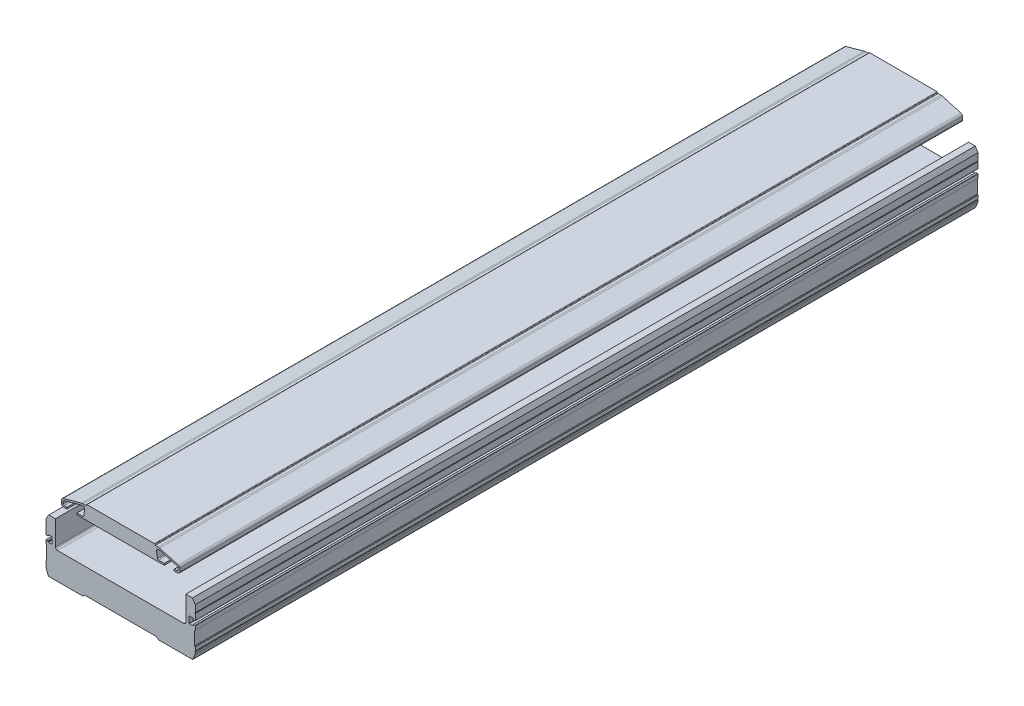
SolidWorks part; units mm, degrees
ref_plane "前视基准面" through (0, 0, 0) normal (0, 0, 1) x (1, 0, 0)
ref_plane "上视基准面" through (0, 0, 0) normal (0, 1, 0) x (1, 0, 0)
ref_plane "右视基准面" through (0, 0, 0) normal (1, 0, 0) x (0, 0, -1)
sketch "草图1" plane through (0, 0, 0) normal (0, 0, 1) x (1, 0, 0)
  line B0 (-51.5, 59.4) -> (-48.5, 59.4)
  line B1 (-48.5, 59.4) -> (-48.5, 60.9)
  line B2 (-48.5, 60.9) -> (-51, 60.9)
  line B3 (-52, 61.9) -> (-52, 63.7046)
  line B4 (-51.27, 64.6675) -> (-35.0485, 69.2164)
  line B5 (-32.5361, 66.9593) -> (-33.4138, 61.7343)
  line B6 (-34.4, 60.9) -> (-39.5, 60.9)
  line B7 (-39.5, 60.9) -> (-39.5, 59.4)
  line B8 (-39.5, 59.4) -> (39.5, 59.4)
  line B9 (39.5, 59.4) -> (39.5, 60.9)
  line B10 (39.5, 60.9) -> (34.4, 60.9)
  line B11 (33.4138, 61.7343) -> (32.5361, 66.9593)
  line B12 (35.0485, 69.2164) -> (51.27, 64.6675)
  line B13 (52, 63.7046) -> (52, 61.9)
  line B14 (51, 60.9) -> (48.5, 60.9)
  line B15 (48.5, 60.9) -> (48.5, 59.4)
  line B16 (48.5, 59.4) -> (51.5, 59.4)
  line B17 (53.5, 61.4) -> (53.5, 64.0837)
  line B18 (52.04, 66.0094) -> (35.2622, 70.7143)
  line B19 (33.9122, 70.9) -> (31.5, 70.9)
  line B20 (30.5, 71.9) -> (-30.5, 71.9)
  line B21 (-31.5, 70.9) -> (-33.9122, 70.9)
  line B22 (-35.2622, 70.7143) -> (-52.04, 66.0094)
  line B23 (-53.5, 64.0837) -> (-53.5, 61.4)
  line B24 (-65.16, -1.6) -> (-34.1, -1.6)
  line B25 (-34.1, -1.6) -> (-32.5, 0)
  line B26 (-32.5, 0) -> (32.5, 0)
  line B27 (32.5, 0) -> (34.1, -1.6)
  line B28 (34.1, -1.6) -> (65.16, -1.6)
  line B29 (65.5064, -1.0289) -> (67.36, 3.6468)
  line B30 (67.5, 4.3812) -> (67.5, 5.625)
  line B31 (67.5, 6.375) -> (67.5, 9.5)
  line B32 (67.5, 9.5) -> (67, 10)
  line B33 (67, 10) -> (67, 22)
  line B34 (67, 22) -> (67.5, 22.5)
  line B35 (67.5, 22.5) -> (67.5, 25.9)
  line B36 (67.2, 26.2) -> (65.8, 26.2)
  line B37 (65.5, 25.9) -> (65.5, 25.3)
  line B38 (65.2, 25) -> (62.3, 25)
  line B39 (62, 25.3) -> (62, 30.7)
  line B40 (62.3, 31) -> (65.2, 31)
  line B41 (65.5, 30.7) -> (65.5, 30.1)
  line B42 (65.8, 29.8) -> (67.2, 29.8)
  line B43 (67.5, 30.1) -> (67.5, 35.625)
  line B44 (67.5, 36.375) -> (67.5, 42.6)
  line B45 (67.5, 42.6) -> (65, 46.6)
  line B46 (65, 46.6) -> (59, 46.6)
  line B47 (59, 46.6) -> (59, 24.7)
  line B48 (57, 22.7) -> (-57, 22.7)
  line B49 (-59, 24.7) -> (-59, 46.6)
  line B50 (-59, 46.6) -> (-65, 46.6)
  line B51 (-65, 46.6) -> (-67.5, 42.6)
  line B52 (-67.5, 42.6) -> (-67.5, 36.375)
  line B53 (-67.5, 35.625) -> (-67.5, 30.1)
  line B54 (-67.2, 29.8) -> (-65.8, 29.8)
  line B55 (-65.5, 30.1) -> (-65.5, 30.7)
  line B56 (-65.2, 31) -> (-62.3, 31)
  line B57 (-62, 30.7) -> (-62, 25.3)
  line B58 (-62.3, 25) -> (-65.2, 25)
  line B59 (-65.5, 25.3) -> (-65.5, 25.9)
  line B60 (-65.8, 26.2) -> (-67.2, 26.2)
  line B61 (-67.5, 25.9) -> (-67.5, 22.5)
  line B62 (-67.5, 22.5) -> (-67, 22)
  line B63 (-67, 22) -> (-67, 10)
  line B64 (-67, 10) -> (-67.5, 9.5)
  line B65 (-67.5, 9.5) -> (-67.5, 6.375)
  line B66 (-67.5, 5.625) -> (-67.5, 4.3812)
  line B67 (-67.36, 3.6468) -> (-65.5064, -1.0289)
  arc B68 (-53.5, 61.4) -> (-51.5, 59.4) centre (-51.5, 61.4) ccw
  arc B69 (-52, 61.9) -> (-51, 60.9) centre (-51, 61.9) ccw
  arc B70 (-51.27, 64.6675) -> (-52, 63.7046) centre (-51, 63.7046) ccw
  arc B71 (-32.5361, 66.9593) -> (-35.0485, 69.2164) centre (-34.5085, 67.2906) ccw
  arc B72 (-34.4, 60.9) -> (-33.4138, 61.7343) centre (-34.4, 61.9) ccw
  arc B73 (33.4138, 61.7343) -> (34.4, 60.9) centre (34.4, 61.9) ccw
  arc B74 (35.0485, 69.2164) -> (32.5361, 66.9593) centre (34.5085, 67.2906) ccw
  arc B75 (52, 63.7046) -> (51.27, 64.6675) centre (51, 63.7046) ccw
  arc B76 (51, 60.9) -> (52, 61.9) centre (51, 61.9) ccw
  arc B77 (51.5, 59.4) -> (53.5, 61.4) centre (51.5, 61.4) ccw
  arc B78 (53.5, 64.0837) -> (52.04, 66.0094) centre (51.5, 64.0837) ccw
  arc B79 (35.2622, 70.7143) -> (33.9122, 70.9) centre (33.9122, 65.9) ccw
  arc B80 (31, 71.4) -> (31.5, 70.9) centre (31.5, 71.4) ccw
  arc B81 (31, 71.4) -> (30.5, 71.9) centre (30.5, 71.4) ccw
  arc B82 (-30.5, 71.9) -> (-31, 71.4) centre (-30.5, 71.4) ccw
  arc B83 (-31.5, 70.9) -> (-31, 71.4) centre (-31.5, 71.4) ccw
  arc B84 (-33.9122, 70.9) -> (-35.2622, 70.7143) centre (-33.9122, 65.9) ccw
  arc B85 (-52.04, 66.0094) -> (-53.5, 64.0837) centre (-51.5, 64.0837) ccw
  arc B86 (-65.5064, -1.0289) -> (-65.16, -1.6) centre (-63.6472, -0.2918) ccw
  arc B87 (65.16, -1.6) -> (65.5064, -1.0289) centre (63.6472, -0.2918) ccw
  arc B88 (67.36, 3.6468) -> (67.5, 4.3812) centre (65.5, 4.382) ccw
  arc B89 (67.5, 6.375) -> (67.5, 5.625) centre (67.5, 6) ccw
  arc B90 (67.5, 25.9) -> (67.2, 26.2) centre (67.2, 25.9) ccw
  arc B91 (65.8, 26.2) -> (65.5, 25.9) centre (65.8, 25.9) ccw
  arc B92 (65.2, 25) -> (65.5, 25.3) centre (65.2, 25.3) ccw
  arc B93 (62, 25.3) -> (62.3, 25) centre (62.3, 25.3) ccw
  arc B94 (62.3, 31) -> (62, 30.7) centre (62.3, 30.7) ccw
  arc B95 (65.5, 30.7) -> (65.2, 31) centre (65.2, 30.7) ccw
  arc B96 (65.5, 30.1) -> (65.8, 29.8) centre (65.8, 30.1) ccw
  arc B97 (67.2, 29.8) -> (67.5, 30.1) centre (67.2, 30.1) ccw
  arc B98 (67.5, 36.375) -> (67.5, 35.625) centre (67.5, 36) ccw
  arc B99 (57, 22.7) -> (59, 24.7) centre (57, 24.7) ccw
  arc B100 (-59, 24.7) -> (-57, 22.7) centre (-57, 24.7) ccw
  arc B101 (-67.5, 35.625) -> (-67.5, 36.375) centre (-67.5, 36) ccw
  arc B102 (-67.5, 30.1) -> (-67.2, 29.8) centre (-67.2, 30.1) ccw
  arc B103 (-65.8, 29.8) -> (-65.5, 30.1) centre (-65.8, 30.1) ccw
  arc B104 (-65.2, 31) -> (-65.5, 30.7) centre (-65.2, 30.7) ccw
  arc B105 (-62, 30.7) -> (-62.3, 31) centre (-62.3, 30.7) ccw
  arc B106 (-62.3, 25) -> (-62, 25.3) centre (-62.3, 25.3) ccw
  arc B107 (-65.5, 25.3) -> (-65.2, 25) centre (-65.2, 25.3) ccw
  arc B108 (-65.5, 25.9) -> (-65.8, 26.2) centre (-65.8, 25.9) ccw
  arc B109 (-67.2, 26.2) -> (-67.5, 25.9) centre (-67.2, 25.9) ccw
  arc B110 (-67.5, 5.625) -> (-67.5, 6.375) centre (-67.5, 6) ccw
  arc B111 (-67.5, 4.3812) -> (-67.36, 3.6468) centre (-65.5, 4.382) ccw
sketch_block_instance "块24-1"
sketch_block "块24"
extrude "凸台-拉伸1" add sketch "草图1" along normal blind 708
hole_wizard "打孔尺寸(%根据)内六角圆柱头螺钉的类型1" positions "草图7" profile "草图5" counterbore size "M6" standard "GB"
sketch "草图7" plane through (0, 46.6, 0) normal (0, 1, 0) x (1, 0, 0)
  line L0 (0, 0) -> (0, -383.8232) construction
  line L3 (-65.16, 0) -> (-34.1, 0) construction
  point P0 (-53, -61.5)
  point P8 (-53, -261.5)
  point P10 (-53, -1061.5)
  point P12 (-53, -661.5)
  point P14 (-53, -461.5)
  point P16 (-53, -1261.5)
  point P18 (-53, -861.5)
  point P34 (53, -861.5)
  point P35 (53, -1261.5)
  point P36 (53, -461.5)
  point P37 (53, -661.5)
  point P38 (53, -1061.5)
  point P39 (53, -261.5)
  point P40 (53, -61.5)
  dimension "D1" = 106
  dimension "D2" = 61.5
  dimension "D3" = 200
  dimension "D4" = 200
  dimension "D5" = 200
  dimension "D6" = 200
  dimension "D7" = 200
  dimension "D8" = 200
sketch "草图5" plane through (-53, 46.6, 61.5) normal (1, 0, 0) x (0, 0, 1)
  line L0 (0, 0) -> (0, 48.2)
  line L1 (0, 48.2) -> (3.5, 48.2)
  line L3 (3.5, 48.2) -> (3.5, 40.9)
  line L4 (3.5, 40.9) -> (5.5, 40.9)
  line L5 (5.5, 40.9) -> (5.5, 0)
  line L7 (5.5, 0) -> (0, 0)
  line L11 (0, -6.35) -> (0, 107.95) construction
  dimension "通孔孔直径" = 7
  dimension "通孔孔深度" = 48.2
  dimension "柱形沉头孔直径" = 11
  dimension "柱形沉头孔深度" = 40.9
hole_wizard "M6 螺纹孔1" positions "草图8" profile "草图9" tap size "M6" standard "GB"
sketch "草图8" plane through (0, -1.6, 0) normal (0, -1, 0) x (-1, 0, 0)
  line L0 (0, 0) -> (0, -43.6644) construction
  line L3 (-34.1, 0) -> (-65.16, 0) construction
  point P0 (-53, -51.5)
  point P7 (53, -51.5)
  point P10 (-53, -251.5)
  point P12 (-53, -451.5)
  point P14 (-53, -651.5)
  point P18 (-53, -851.5)
  point P20 (-53, -1051.5)
  point P21 (53, -1051.5)
  point P22 (53, -851.5)
  point P23 (53, -651.5)
  point P24 (53, -451.5)
  point P25 (53, -251.5)
  point P28 (-53, -1251.5)
  point P34 (53, -1251.5)
  dimension "D1" = 106
  dimension "D2" = 51.5
  dimension "D3" = 200
  dimension "D4" = 200
  dimension "D5" = 200
  dimension "D6" = 200
  dimension "D7" = 200
  dimension "D8" = 200
sketch "草图9" plane through (53, -1.6, 51.5) normal (1, 0, 0) x (0, 0, -1)
  line L0 (0, 0) -> (0, 12.5022)
  line L1 (0, 12.5022) -> (2.5, 11)
  line L2 (2.5, 11) -> (2.5, 0)
  line L5 (2.5, 0) -> (0, 0)
  line L10 (0, 12.5022) -> (-2.5, 11) construction
  line L11 (0, -6.35) -> (0, 107.95) construction
  dimension "螺纹孔钻头直径" = 5
  dimension "螺纹孔钻头深度" = 11
  dimension "导头角度" = 118
